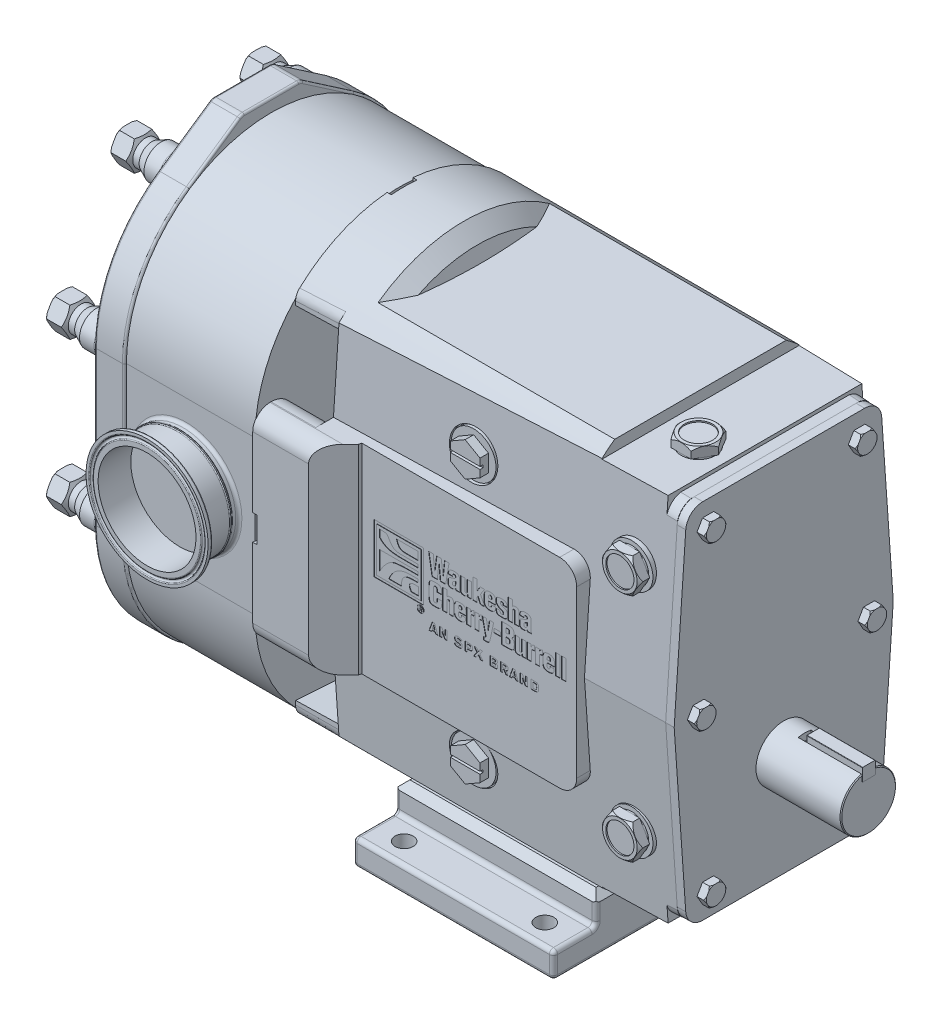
SolidWorks part; units mm, degrees
ref_plane "Front Plane" through (0, 0, 0) normal (0, 0, 1) x (1, 0, 0)
ref_plane "Top Plane" through (0, 0, 0) normal (0, 1, 0) x (1, 0, 0)
ref_plane "Right Plane" through (0, 0, 0) normal (1, 0, 0) x (0, 0, -1)
other "Join1"
other "grease fitting<4>@130_U2_Lower Shaft"
other "grease fitting<2>@130_U2_Lower Shaft"
other "cleanout plug<2>@130_U2_Lower Shaft"
other "oil plug<4>@130_U2_Lower Shaft"
other "oil plug<2>@130_U2_Lower Shaft"
other "108371<8>@130_U2_Lower Shaft"
other "108371<7>@130_U2_Lower Shaft"
other "108371<6>@130_U2_Lower Shaft"
other "108371<4>@130_U2_Lower Shaft"
other "108371<3>@130_U2_Lower Shaft"
other "108371<2>@130_U2_Lower Shaft"
other "Key_060<1>@130_U2_Lower Shaft"
other "grease fitting<3>@130_U2_Lower Shaft"
other "grease fitting<1>@130_U2_Lower Shaft"
other "oil plug<6>@130_U2_Lower Shaft"
other "oil plug<5>@130_U2_Lower Shaft"
other "cleanout plug<1>@130_U2_Lower Shaft"
other "oil plug<3>@130_U2_Lower Shaft"
other "oil plug<1>@130_U2_Lower Shaft"
other "Shaft_060<1>@130_U2_Lower Shaft"
other "plate_060<1>@130_U2_Lower Shaft"
other "108371<5>@130_U2_Lower Shaft"
other "108371<1>@130_U2_Lower Shaft"
other "101848<1>@130_U2_Lower Shaft"
other "101868<1>@130_U2_Lower Shaft"
other "070110000<1>@130_U2_Lower Shaft"
other "070005000<1>@130_U2_Lower Shaft"
other "130360008<2>@130_U2_Lower Shaft"
other "130360008<1>@130_U2_Lower Shaft"
